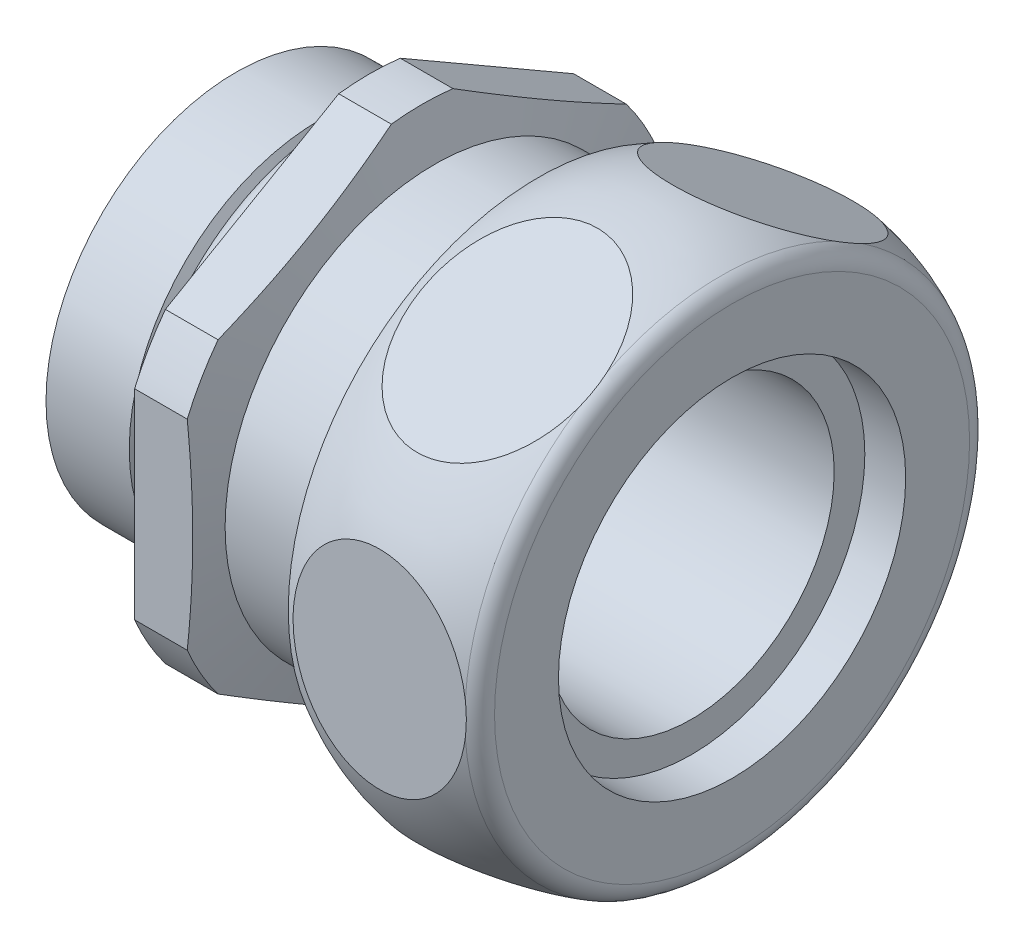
SolidWorks part; units mm, degrees
ref_plane "Vorne" through (0, 0, 0) normal (0, 0, 1) x (1, 0, 0)
ref_plane "Oben" through (0, 0, 0) normal (0, 1, 0) x (1, 0, 0)
ref_plane "Rechts" through (0, 0, 0) normal (1, 0, 0) x (0, 0, -1)
sketch "Skizze1" plane through (0, 0, 0) normal (0, 0, 1) x (1, 0, 0)
  line L0 (-9.75, 5.75) -> (20.25, 5.75)
  line L1 (20.25, 5.75) -> (20.25, 6.5)
  line L2 (20.25, 6.5) -> (15, 6.5)
  line L3 (15, 6.5) -> (15, 11.6281)
  line L4 (5.5, 12.2272) -> (5.5, 10.25)
  line L5 (5.5, 10.25) -> (0.43, 10.25)
  line L6 (0.43, 10.25) -> (-0.1729, 12.5)
  line L7 (-0.1729, 12.5) -> (-2.75, 12.5)
  line L8 (-2.75, 12.5) -> (-2.75, 8.5)
  line L9 (-2.75, 8.5) -> (-4.75, 8.5)
  line L10 (-4.75, 8.5) -> (-5.2119, 9.3)
  line L11 (-5.2119, 9.3) -> (-9.2881, 9.3)
  line L12 (-9.2881, 9.3) -> (-9.75, 8.5)
  line L13 (-9.75, 8.5) -> (-9.75, 5.75)
  line L14 (50, 0) -> (-50, 0) construction
  arc A0 (15, 11.6281) -> (14.4412, 12.5255) centre (14, 11.6281) ccw
  arc A1 (14.4412, 12.5255) -> (5.5, 12.2272) centre (10.25, 4) ccw
revolve "Rotation1" add sketch "Skizze1" angle 360 about L14
ref_plane "Ebene1" through (-2.75, 0, 0) normal (1, 0, 0) x (0, 0, -1)
sketch "Skizze2" plane through (-2.75, 0, 0) normal (1, 0, 0) x (0, 0, -1)
  line L0 (-11.5, 6.6395) -> (-11.5, -6.6395)
  line L1 (-11.5, -6.6395) -> (0, -13.2791)
  line L2 (0, -13.2791) -> (11.5, -6.6395)
  line L3 (11.5, -6.6395) -> (11.5, 6.6395)
  line L4 (11.5, 6.6395) -> (0, 13.2791)
  line L5 (0, 13.2791) -> (-11.5, 6.6395)
  circle A0 centre (0, 0) radius 23
extrude "Schnitt-Linear austragen1" cut sketch "Skizze2" along normal blind 3.16
ref_plane "Ebene2" through (15, 0, 0) normal (1, 0, 0) x (0, 0, -1)
sketch "Skizze3" plane through (15, 0, 0) normal (1, 0, 0) x (0, 0, -1)
  line L0 (-12.5, 7.2169) -> (-12.5, -7.2169)
  line L1 (-12.5, -7.2169) -> (0, -14.4338)
  line L2 (0, -14.4338) -> (12.5, -7.2169)
  line L3 (12.5, -7.2169) -> (12.5, 7.2169)
  line L4 (12.5, 7.2169) -> (0, 14.4338)
  line L5 (0, 14.4338) -> (-12.5, 7.2169)
  circle A0 centre (0, 0) radius 25
extrude "Schnitt-Linear austragen2" cut sketch "Skizze3" against normal blind 9.5
sketch "Skizze4" plane through (0, 0, 0) normal (0, 0, 1) x (1, 0, 0)
  line L0 (50, 0) -> (-50, 0) construction
  circle A0 centre (-3.45, 9.45) radius 0.9
revolve "Rotation2" add sketch "Skizze4" angle 360 about L0
sketch "Skizze5" plane through (0, 0, 0) normal (0, 0, 1) x (1, 0, 0)
  line L0 (-9.75, 0) -> (-9.75, 5.76)
  line L1 (-9.75, 5.76) -> (-2.75, 5.76)
  line L2 (-2.75, 5.76) -> (-2.75, 0)
  line L3 (-2.75, 0) -> (-9.75, 0)
  line L4 (-2.75, 0) -> (-9.75, 0) construction
revolve "Schnitt-Rotation1" cut sketch "Skizze5" angle 360 about L4
ref_plane "Ebene3" through (15, 0, 0) normal (1, 0, 0) x (0, 0, -1)
sketch "Skizze6" plane through (15, 0, 0) normal (1, 0, 0) x (0, 0, -1)
  circle A0 centre (0, 0) radius 8.5
  circle A1 centre (0, 0) radius 6.5
extrude "Schnitt-Linear austragen3" cut sketch "Skizze6" against normal blind 2
sketch "Skizze7" plane through (0, 0, 0) normal (0, 0, 1) x (1, 0, 0)
  line L0 (-9.75, 7) -> (20.6574, 7)
  line L1 (-9.75, 8.5) -> (-9.75, -8.5) construction
  line L2 (20.6574, 7) -> (20.6574, 0)
  line L3 (20.6574, 0) -> (-9.75, 0)
  line L4 (-9.75, 5.76) -> (-9.75, -5.76) construction
  line L5 (-9.75, 0) -> (-9.75, 7)
  dimension "D1" = 7
revolve "Schnitt-Rotation2" cut sketch "Skizze7" angle 360 about L3
